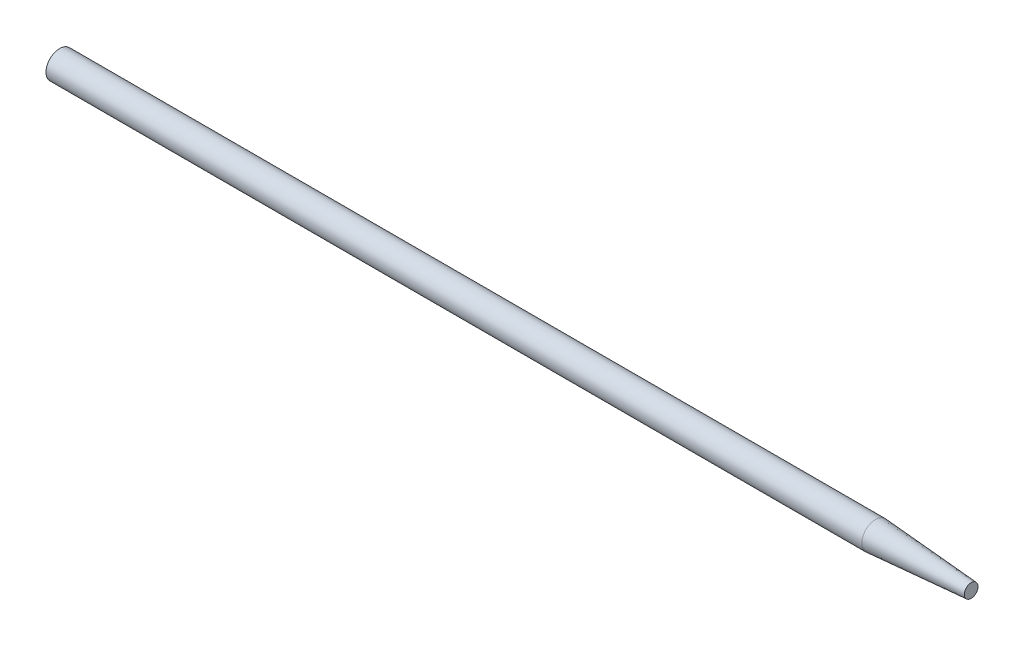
SolidWorks part; units mm, degrees
ref_plane "Ön Düzlem" through (0, 0, 0) normal (0, 0, 1) x (1, 0, 0)
ref_plane "Üst Düzlem" through (0, 0, 0) normal (0, 1, 0) x (1, 0, 0)
ref_plane "Sağ Düzlem" through (0, 0, 0) normal (1, 0, 0) x (0, 0, -1)
sketch "Çizim1" plane through (0, 0, 0) normal (0, 0, 1) x (1, 0, 0)
  line L0 (500, 3.75) -> (447.5067, 7.5)
  line L1 (0, 0) -> (500, 0)
  line L2 (0, 0) -> (0, 7.5)
  line L3 (0, 7.5) -> (447.5067, 7.5)
  line L4 (500, 0) -> (500, 3.75)
revolve "Döndür1" add sketch "Çizim1" angle 360 about L1
